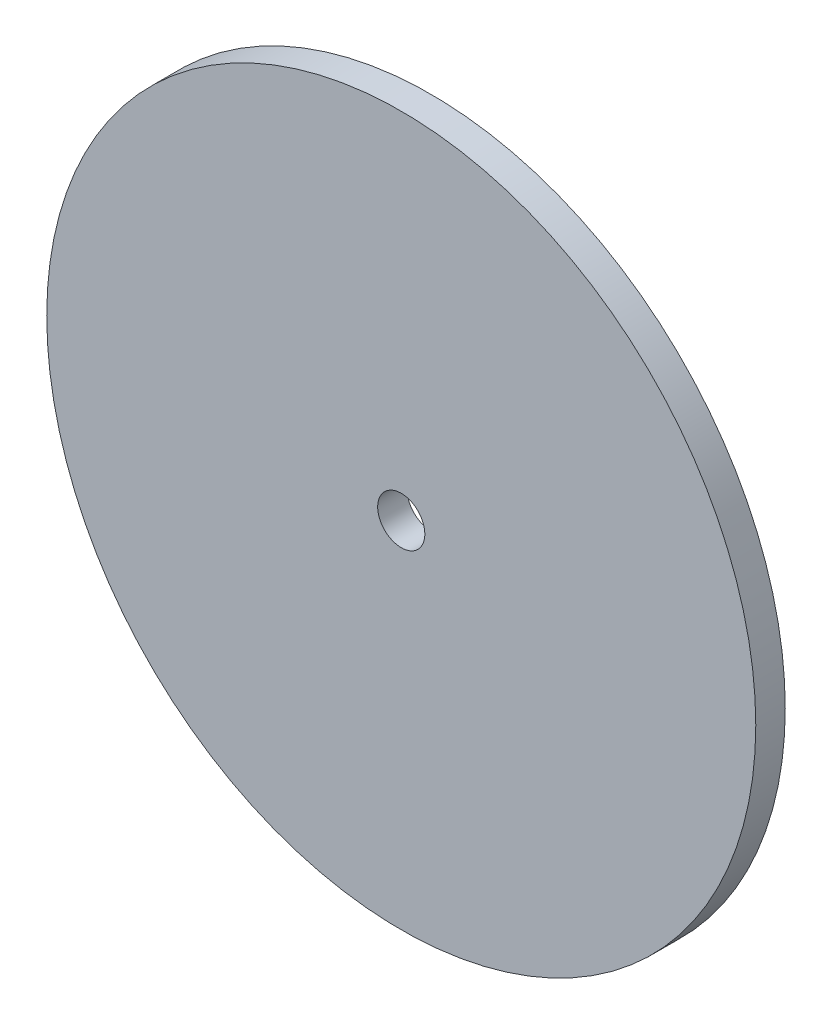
SolidWorks part; units mm, degrees
ref_plane "Front Plane" through (0, 0, 0) normal (0, 0, 1) x (1, 0, 0)
ref_plane "Top Plane" through (0, 0, 0) normal (0, 1, 0) x (1, 0, 0)
ref_plane "Right Plane" through (0, 0, 0) normal (1, 0, 0) x (0, 0, -1)
sketch "Sketch1" plane through (0, 0, 0) normal (0, 0, 1) x (1, 0, 0)
  circle A0 centre (0, 0) radius 60.15
  circle A1 centre (0, 0) radius 4
  dimension "D1" = 120.3
  dimension "D2" = 8
extrude "Boss-Extrude2" add sketch "Sketch1" along normal blind 5
